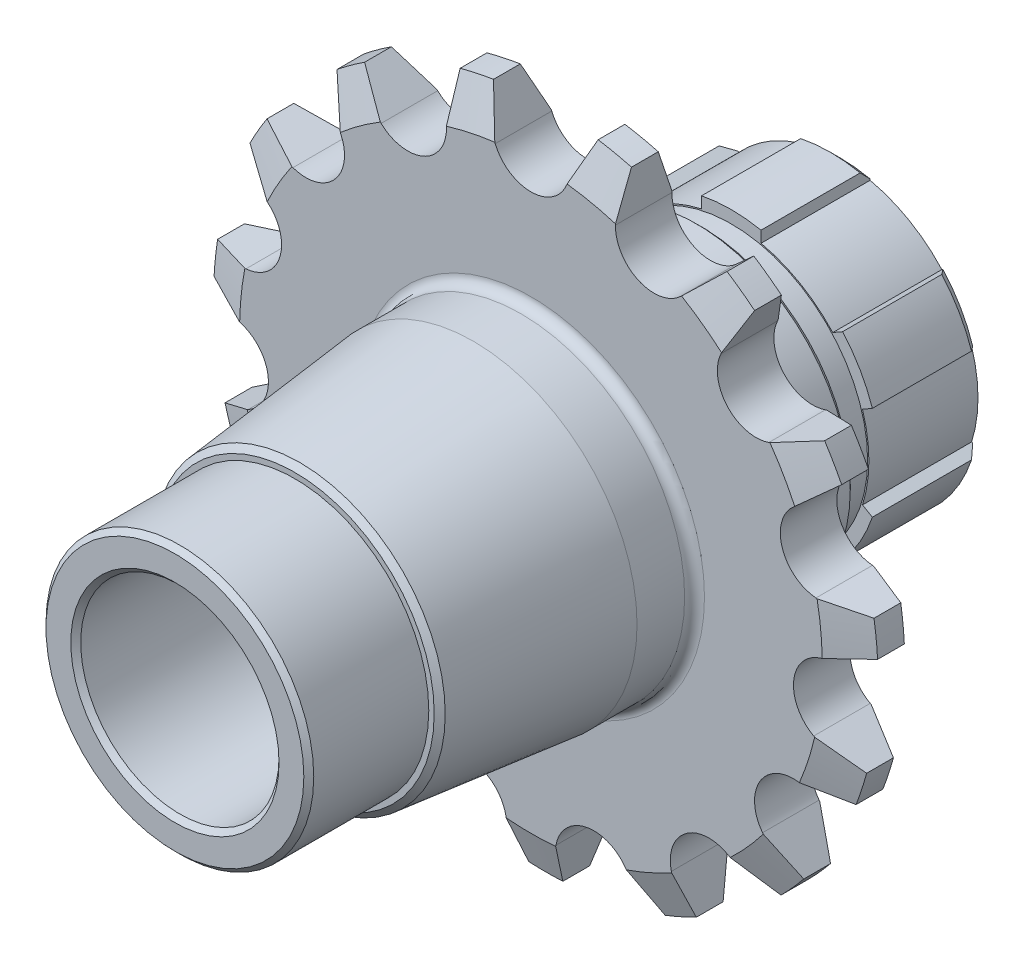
SolidWorks part; units mm, degrees
ref_plane "正面" through (0, 0, 0) normal (0, 0, 1) x (1, 0, 0)
ref_plane "平面" through (0, 0, 0) normal (0, 1, 0) x (1, 0, 0)
ref_plane "右側面" through (0, 0, 0) normal (1, 0, 0) x (0, 0, -1)
sketch "ｽｹｯﾁ1" plane through (0, 0, 0) normal (0, 0, 1) x (1, 0, 0)
  circle A0 centre (0, 0) radius 15
  dimension "D1" = 30
extrude "ﾎﾞｽ - 押し出し1" add sketch "ｽｹｯﾁ1" along normal blind 14
sketch "ｽｹｯﾁ2" plane through (0, 0, 14) normal (0, 0, 1) x (1, 0, 0)
  circle A0 centre (0, 0) radius 13.75
  dimension "D1" = 27.5
extrude "ｶｯﾄ - 押し出し1" cut sketch "ｽｹｯﾁ2" against normal blind 3 flip side to cut
sketch "ｽｹｯﾁ3" plane through (0, 0, 14) normal (0, 0, 1) x (1, 0, 0)
  circle A0 centre (0, 0) radius 15.5
  dimension "D1" = 31
extrude "ﾎﾞｽ - 押し出し2" add sketch "ｽｹｯﾁ3" along normal blind 11.5
sketch "ｽｹｯﾁ4" plane through (0, 0, 25.5) normal (0, 0, 1) x (1, 0, 0)
  circle A0 centre (0, 0) radius 16.5
  dimension "D1" = 33
extrude "ﾎﾞｽ - 押し出し4" add sketch "ｽｹｯﾁ4" along normal offset from surface (29.5 mm away) 41
chamfer "面取り1" distance 18 angle 6 1 edges at (16.5, 0, 55)
sketch "ｽｹｯﾁ5" plane through (0, 0, 55) normal (0, 0, 1) x (1, 0, 0)
  circle A0 centre (0, 0) radius 13.5
  dimension "D1" = 27
extrude "ﾎﾞｽ - 押し出し5" add sketch "ｽｹｯﾁ5" along normal offset from surface (12.1 mm away) 67.1
sketch "ｽｹｯﾁ6" plane through (0, 0, 67.1) normal (0, 0, 1) x (1, 0, 0)
  circle A0 centre (0, 0) radius 10
  dimension "D1" = 20
extrude "ｶｯﾄ - 押し出し2" cut sketch "ｽｹｯﾁ6" against normal through all
sketch "ｽｹｯﾁ7" plane through (0, 0, 67.1) normal (0, 0, 1) x (1, 0, 0)
  circle A0 centre (0, 0) radius 10.5
  dimension "D1" = 21
extrude "ｶｯﾄ - 押し出し3" cut sketch "ｽｹｯﾁ7" against normal blind 34.1 from offset 16.5
chamfer "面取り2" distance 1 angle 45 1 edges at (15, 0, 0)
chamfer "面取り3" distance 0.5 angle 45 1 edges at (15.5, 0, 14)
chamfer "面取り4" distance 0.5 angle 45 1 edges at (10, 0, 0)
chamfer "面取り5" distance 0.5 angle 45 2 edges at (13.5, 0, 67.1) (10, 0, 67.1)
chamfer "面取り6" distance 0.5 angle 45 1 edges at (14.6081, 0, 55)
sketch "ｽｹｯﾁ8" plane through (0, 0, 0) normal (0, 0, -1) x (-1, 0, 0)
  line L0 (3, 19.3761) -> (3, 13.5519)
  line L1 (10.2363, 9.374) -> (14.4514, 11.8076)
  line L2 (0, 0) -> (16.736, 9.6625) construction
  line L3 (0, 0) -> (0, 23.6616) construction
  line L4 (3, 19.3761) -> (14.4514, 11.8076)
  arc A1 (3, 13.5519) -> (10.2363, 9.374) centre (0, 0) cw
  dimension "D1" = 13.88
  dimension "D2" = 3
  dimension "D3" = 3
  dimension "D4" = 60
extrude "ｶｯﾄ - 押し出し4" cut sketch "ｽｹｯﾁ8" against normal up to surface (11 mm away)
pattern_circular "円形ﾊﾟﾀｰﾝ1" count 6 over 360 about axis through (0, 0, 0) along (0, 0, 1) of "ｶｯﾄ - 押し出し4"
sketch "ｽｹｯﾁ9" plane through (0, 0, 25.5) normal (0, 0, -1) x (-1, 0, 0)
  circle A0 centre (0, 0) radius 33.5
  circle A1 centre (0, 0) radius 16.5
  circle A2 centre (0, 0) radius 16.5 construction
  dimension "D1" = 67
extrude "ﾎﾞｽ - 押し出し6" add sketch "ｽｹｯﾁ9" against normal blind 5.7
chamfer "面取り7" distance 1.5 angle 70 2 edges at (-33.5, 0, 31.2) (-33.5, 0, 25.5)
sketch "ｽｹｯﾁ10" plane through (0, 0, 25.5) normal (0, 0, -1) x (-1, 0, 0)
  line L0 (0, 30.54) -> (0, 0) construction
  line L1 (3.6031, 29.0475) -> (5.2743, 33.0822)
  line L2 (-3.6031, 29.0475) -> (-5.2743, 33.0822)
  arc A0 (-3.6031, 29.0475) -> (3.6031, 29.0475) centre (0, 30.54) ccw
  arc A1 (5.2743, 33.0822) -> (-5.2743, 33.0822) centre (0, 0) ccw
  circle A2 centre (0, 0) radius 33.5 construction
  point P6 (4.9686, 33.1295)
  point P11 (0, 0)
  dimension "D1" = 3.9
  dimension "D3" = 45
  dimension "D2" = 30.54
extrude "ｶｯﾄ - 押し出し5" cut sketch "ｽｹｯﾁ10" against normal through all
pattern_circular "円形ﾊﾟﾀｰﾝ2" count 15 over 360 about axis through (0, 0, 0) along (0, 0, 1) of "ｶｯﾄ - 押し出し5"
fillet "ﾌｨﾚｯﾄ1" radius 1 1 edges at (15.5, 0, 25.5)
sketch "ｽｹｯﾁ11" plane through (0, 0, 31.2) normal (0, 0, -1) x (-1, 0, 0)
  circle A0 centre (0, 0) radius 16.5
  circle A1 centre (0, 0) radius 22.5
  circle A3 centre (0, 0) radius 16.5 construction
  dimension "D1" = 45
extrude "ｶｯﾄ - 押し出し6" [suppressed] cut sketch "ｽｹｯﾁ11" along normal blind 1.2
fillet "ﾌｨﾚｯﾄ2" [suppressed] radius 1
fillet "ﾌｨﾚｯﾄ3" radius 1 1 edges at (-16.5, 0, 31.2)
